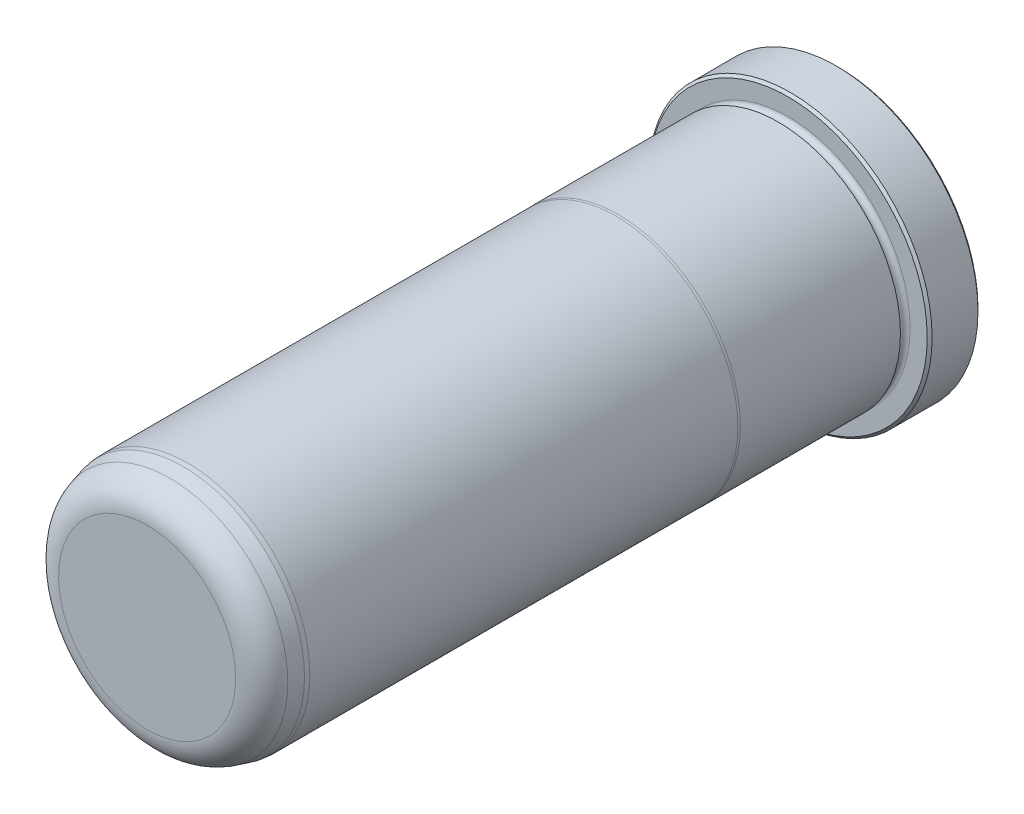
SolidWorks part; units mm, degrees
ref_plane "Front Plane" through (0, 0, 0) normal (0, 0, 1) x (1, 0, 0)
ref_plane "Top Plane" through (0, 0, 0) normal (0, 1, 0) x (1, 0, 0)
ref_plane "Right Plane" through (0, 0, 0) normal (1, 0, 0) x (0, 0, -1)
sketch "Sketch1" plane through (0, 0, 0) normal (1, 0, 0) x (0, 0, -1)
  line L0 (0, 0) -> (0, 22.098)
  line L1 (0, 22.098) -> (-7.9248, 22.098)
  line L2 (-7.9248, 22.098) -> (-7.9248, 19.0373)
  line L3 (-7.9248, 18.2753) -> (-9.4488, 18.2753) construction
  line L4 (-9.4488, 19.0373) -> (-9.4488, 19.0627)
  line L5 (-9.4488, 19.0627) -> (-34.4348, 19.0627)
  line L6 (-34.4348, 19.0627) -> (-34.798, 19.0373)
  line L7 (-34.798, 19.0373) -> (-101.6, 19.0373)
  line L9 (-107.95, 17.4733) -> (-107.95, 0)
  line L10 (-107.95, 0) -> (0, 0)
  line L11 (0, 0) -> (13.6287, 0) construction
  line L12 (-101.6, 19.0373) -> (-102.362, 18.9706)
  line L13 (-102.362, 18.9706) -> (-107.95, 17.4733)
  arc A0 (-9.4488, 19.0373) -> (-7.9248, 19.0373) centre (-8.6868, 19.0373) ccw
  dimension "D14" = 1.524
  dimension "D1" = 7.9248
  dimension "D2" = 1.524
  dimension "D3" = 44.196
  dimension "D4" = 38.1254
  dimension "D5" = 34.798
  dimension "D6" = 107.95
  dimension "D7" = 0.7874
  dimension "D8" = 4
  dimension "D9" = 38.0746
  dimension "D10" = 5
  dimension "D11" = 15
  dimension "D12" = 0.762
  dimension "D13" = 6.35
revolve "Revolve1" add sketch "Sketch1" angle 360 about L11
fillet "Fillet6" radius 4.7625 1 edges at (17.4733, 0, 107.95)
chamfer "Chamfer1" distance 0.381 angle 45 2 edges at (22.098, 0, 0) (22.098, 0, 7.9248)
